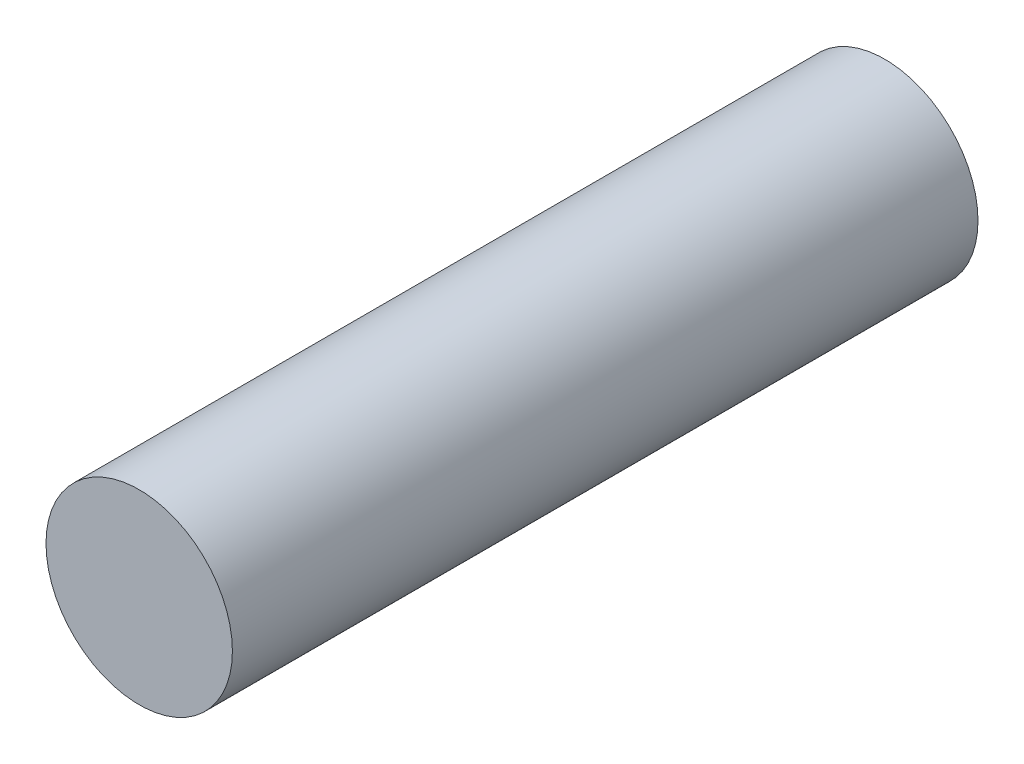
SolidWorks part; units mm, degrees
ref_plane "Plan de face" through (0, 0, 0) normal (0, 0, 1) x (1, 0, 0)
ref_plane "Plan de dessus" through (0, 0, 0) normal (0, 1, 0) x (1, 0, 0)
ref_plane "Plan de droite" through (0, 0, 0) normal (1, 0, 0) x (0, 0, -1)
sketch "Esquisse1" plane through (0, 0, 0) normal (0, 0, 1) x (1, 0, 0)
  circle A0 centre (0, 0) radius 0.5
extrude "Boss.-Extru.1" add sketch "Esquisse1" along normal mid plane 4
